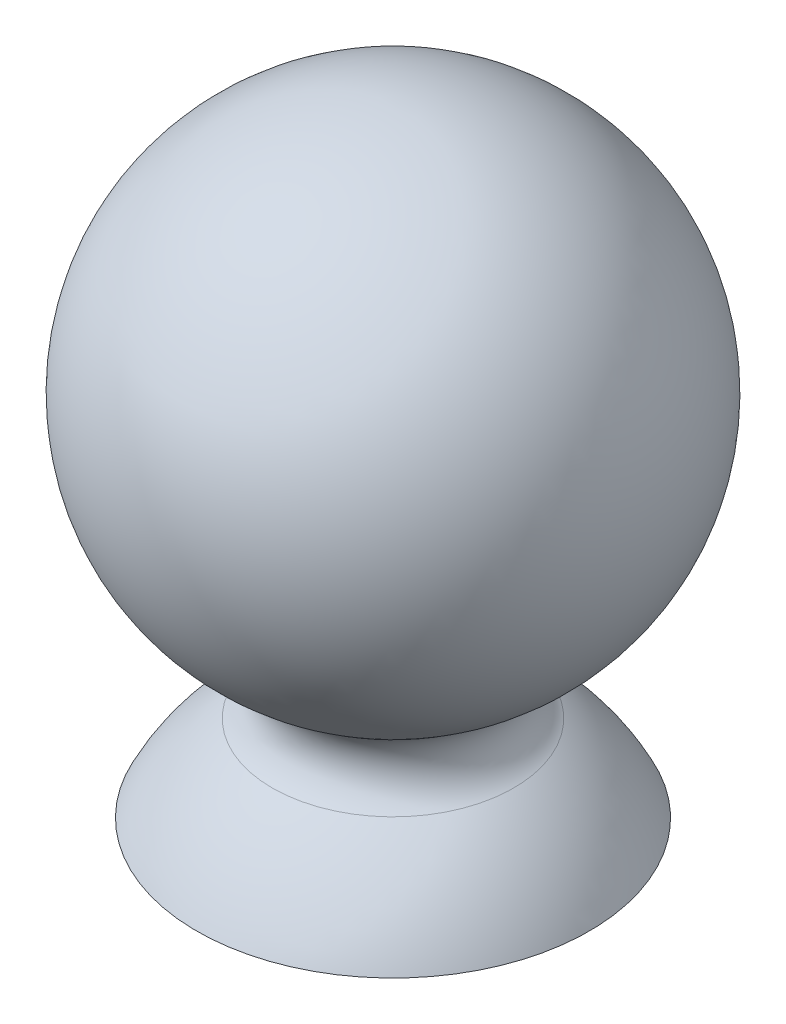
SolidWorks part; units mm, degrees
ref_plane "Front Plane" through (0, 0, 0) normal (0, 0, 1) x (1, 0, 0)
ref_plane "Top Plane" through (0, 0, 0) normal (0, 1, 0) x (1, 0, 0)
ref_plane "Right Plane" through (0, 0, 0) normal (1, 0, 0) x (0, 0, -1)
sketch "Sketch1" plane through (0, 0, 0) normal (0, 0, 1) x (1, 0, 0)
  line L0 (0, 30) -> (0, -30)
  line L1 (0, -45) -> (-24, -45)
  line L2 (0, -45) -> (0, -30)
  arc A0 (0, 30) -> (-15.0295, -25.9637) centre (0, 0) ccw
  arc A1 (-24, -45) -> (-14.7687, -34.4565) centre (0, -56.7) cw
  arc A2 (-15.0295, -25.9637) -> (-14.7687, -34.4565) centre (-17.5344, -30.291) cw
  dimension "D1" = 30
  dimension "D3" = 5
  dimension "D2" = 24
revolve "Revolve1" add sketch "Sketch1" angle 360 about L0
sketch "Sketch2" plane through (0, -45, 0) normal (0, -1, 0) x (1, 0, 0)
  line L0 (-5.25, -5.25) -> (5.25, -5.25)
  line L1 (5.25, -5.25) -> (5.25, 5.25)
  line L2 (5.25, 5.25) -> (-5.25, 5.25)
  line L3 (-5.25, 5.25) -> (-5.25, -5.25)
extrude "Cut-Extrude1" cut sketch "Sketch2" against normal blind 5.5
sketch "Sketch4" plane through (0, -45, 0) normal (0, -1, 0) x (1, 0, 0)
  line L2 (-17, 13) -> (-17, 10)
  line L3 (17, 13) -> (17, 10)
  line L4 (13, 17) -> (10, 17)
  line L5 (13, -17) -> (10, -17)
  line L6 (17, -13) -> (17, -10)
  line L7 (-17, -13) -> (-17, -10)
  line L8 (-13, -17) -> (-10, -17)
  line L9 (-13, 17) -> (-10, 17)
  arc A0 (-17, 13) -> (-13.6534, 13.6534) centre (0, -65.1729) cw
  arc A1 (-17, 10) -> (-14.125, 10.5759) centre (0, -67.4052) cw
  arc A2 (13, 17) -> (13.6534, 13.6534) centre (-65.1729, 0) cw
  arc A3 (10, 17) -> (10.5759, 14.125) centre (-67.4052, 0) cw
  arc A4 (17, -13) -> (13.6534, -13.6534) centre (0, 65.1729) cw
  arc A5 (17, -10) -> (14.125, -10.5759) centre (0, 67.4052) cw
  arc A6 (-13, -17) -> (-13.6534, -13.6534) centre (65.1729, 0) cw
  arc A7 (-10, -17) -> (-10.5759, -14.125) centre (67.4052, 0) cw
  arc A8 (-10.5759, 14.125) -> (10.5759, 14.125) centre (0, -65.1729) cw
  arc A9 (-13.6534, 13.6534) -> (-13, 17) centre (65.1729, 0) cw
  arc A10 (-10.5759, 14.125) -> (-10, 17) centre (67.4052, 0) cw
  arc A11 (-11.0681, 11.0681) -> (11.0681, 11.0681) centre (0, -67.4052) cw
  arc A12 (13.6534, 13.6534) -> (17, 13) centre (0, -65.1729) cw
  arc A13 (11.0681, 11.0681) -> (11.0681, -11.0681) centre (-67.4052, 0) cw
  arc A14 (14.125, 10.5759) -> (14.125, -10.5759) centre (-65.1729, 0) cw
  arc A15 (14.125, 10.5759) -> (17, 10) centre (0, -67.4052) cw
  arc A16 (11.0681, -11.0681) -> (-11.0681, -11.0681) centre (0, 67.4052) cw
  arc A17 (10.5759, -14.125) -> (-10.5759, -14.125) centre (0, 65.1729) cw
  arc A18 (13.6534, -13.6534) -> (13, -17) centre (-65.1729, 0) cw
  arc A19 (10.5759, -14.125) -> (10, -17) centre (-67.4052, 0) cw
  arc A20 (-11.0681, -11.0681) -> (-11.0681, 11.0681) centre (67.4052, 0) cw
  arc A21 (-14.125, -10.5759) -> (-14.125, 10.5759) centre (65.1729, 0) cw
  arc A22 (-14.125, -10.5759) -> (-17, -10) centre (0, 67.4052) cw
  arc A23 (-13.6534, -13.6534) -> (-17, -13) centre (0, 65.1729) cw
  point P33 (0, 0)
  dimension "D7" = 80
  dimension "D8" = 79.25
  dimension "D1" = 3
  dimension "D2" = 3
  dimension "D5" = 34
  dimension "D9" = 4
extrude "Cut-Extrude2" cut sketch "Sketch4" against normal blind 4
equation "\"D3@Sketch2\"=\"D1@Sketch2\"/2"
equation "\"D4@Sketch2\"=\"D2@Sketch2\"/2"
